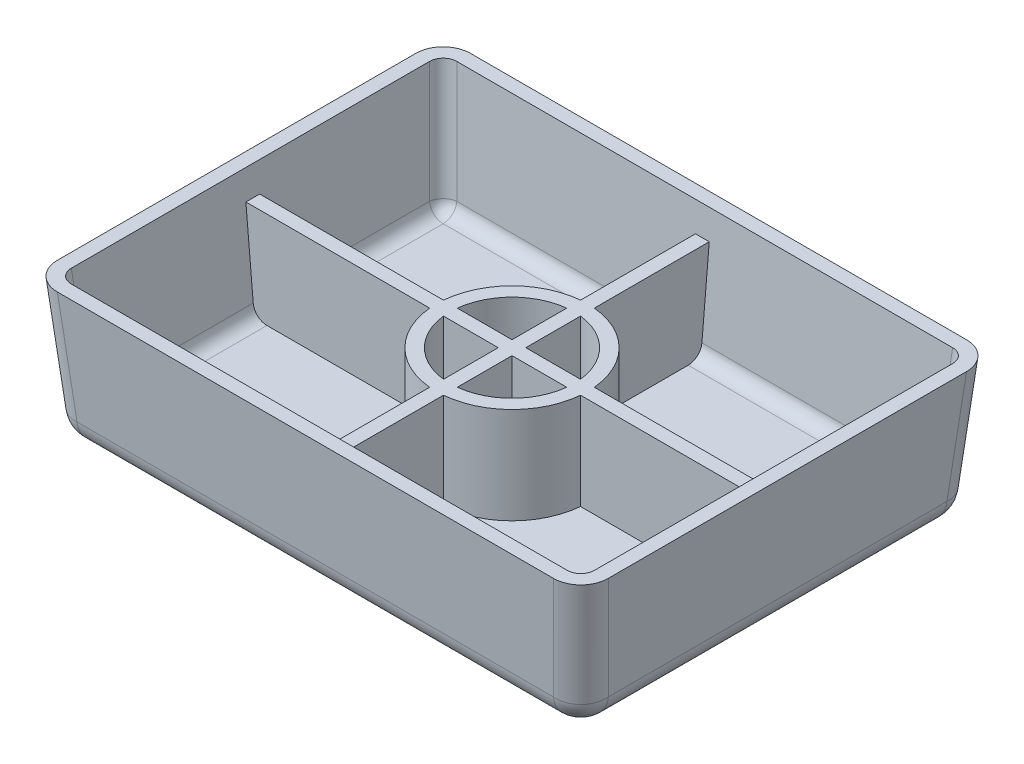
SolidWorks part; units mm, degrees
ref_plane "Front Plane" through (0, 0, 0) normal (0, 0, 1) x (1, 0, 0)
ref_plane "Top Plane" through (0, 0, 0) normal (0, 1, 0) x (1, 0, 0)
ref_plane "Right Plane" through (0, 0, 0) normal (1, 0, 0) x (0, 0, -1)
sketch "Sketch1" plane through (0, 0, 0) normal (0, 1, 0) x (1, 0, 0)
  line L0 (-50.8, -38.1) -> (50.8, 38.1) construction
  line L1 (-50.8, -38.1) -> (50.8, -38.1)
  line L2 (-50.8, -38.1) -> (-50.8, 38.1)
  line L3 (-50.8, 38.1) -> (50.8, 38.1)
  line L4 (50.8, -38.1) -> (50.8, 38.1)
  line L5 (50.8, 38.1) -> (50.4334, 38.4666) construction
  dimension "D1" = 101.6
  dimension "D2" = 76.2
extrude "Extrude1" add sketch "Sketch1" against normal blind 25.4 draft 5
fillet "Fillet1" radius 5.08 8 edges at (0, -25.4, 35.8778) (48.5778, -25.4, 0) (0, -25.4, -35.8778) (-48.5778, -25.4, 0) (-49.6889, -12.7, -36.9889) (49.6889, -12.7, -36.9889) (-49.6889, -12.7, 36.9889) (49.6889, -12.7, 36.9889)
shell "Shell1" thickness 2.54
ref_plane "Plane1" through (0, -5.08, 0) normal (0, 1, 0) x (-1, 0, 0)
sketch "Sketch2" plane through (0, -5.08, 0) normal (0, 1, 0) x (-1, 0, 0)
  line L0 (0, 19.3051) -> (0, -18.8164)
  line L1 (-19.2237, 0) -> (18.8979, 0)
  circle A0 centre (0, 0) radius 12.7
rib "Rib1" sketch "Sketch2" sketch "Sketch2" thickness 2.54 extrusion direction normal to sketch draft on no parameters "D1"=2.54
